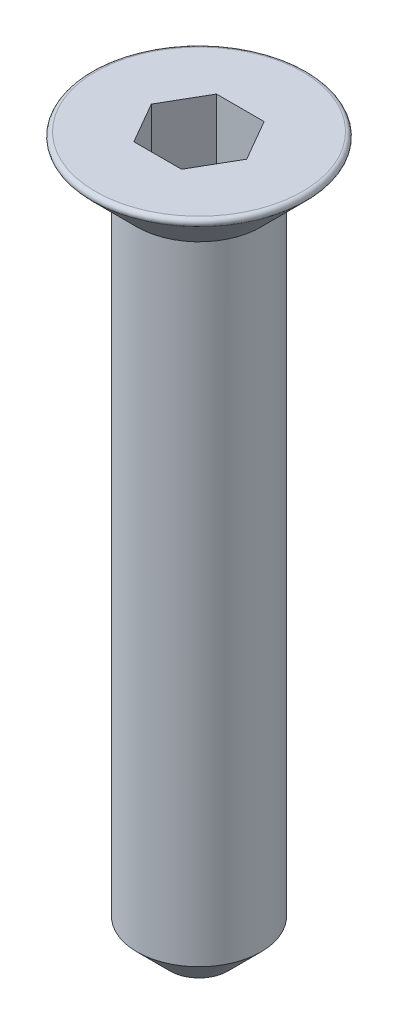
SolidWorks part; units mm, degrees
ref_plane "Plan de face" through (0, 0, 0) normal (0, 0, 1) x (1, 0, 0)
ref_plane "Plan de dessus" through (0, 0, 0) normal (0, 1, 0) x (1, 0, 0)
ref_plane "Plan de droite" through (0, 0, 0) normal (1, 0, 0) x (0, 0, -1)
sketch "Esquisse1" plane through (0, 0, 0) normal (0, 0, 1) x (1, 0, 0)
  line L0 (0, 15.488) -> (0, -29.9279) construction
  line L1 (0, 0) -> (-2.75, 0)
  line L2 (-2.75, 0) -> (-1.5, -1.25)
  line L3 (-1.5, -1.25) -> (-1.5, -17.25)
  line L4 (-1.5, -17.25) -> (0, -17.25)
  line L5 (0, 0) -> (0, -17.25)
  dimension "D1" = 2.75
  dimension "D2" = 1.5
  dimension "D3" = 45
  dimension "D4" = 16
revolve "Révolution1" add sketch "Esquisse1" angle 360 about L0
fillet "Congé1" radius 0.1 1 edges at (0, 0, 2.75)
chamfer "Chanfrein1" distance 0.8 angle 45 1 edges at (0, -17.25, 1.5)
sketch "Esquisse2" plane through (0, 0, 0) normal (0, 1, 0) x (1, 0, 0)
  line L1 (1.1547, 0) -> (0.5774, 1)
  line L2 (0.5774, 1) -> (-0.5774, 1)
  line L3 (-0.5774, 1) -> (-1.1547, 0)
  line L4 (-1.1547, 0) -> (-0.5774, -1)
  line L5 (-0.5774, -1) -> (0.5774, -1)
  line L6 (0.5774, -1) -> (1.1547, 0)
  circle A0 centre (0, 0) radius 1 construction
  dimension "D1" = 2
extrude "Enlèv. mat.-Extru.1" cut sketch "Esquisse2" against normal blind 3
